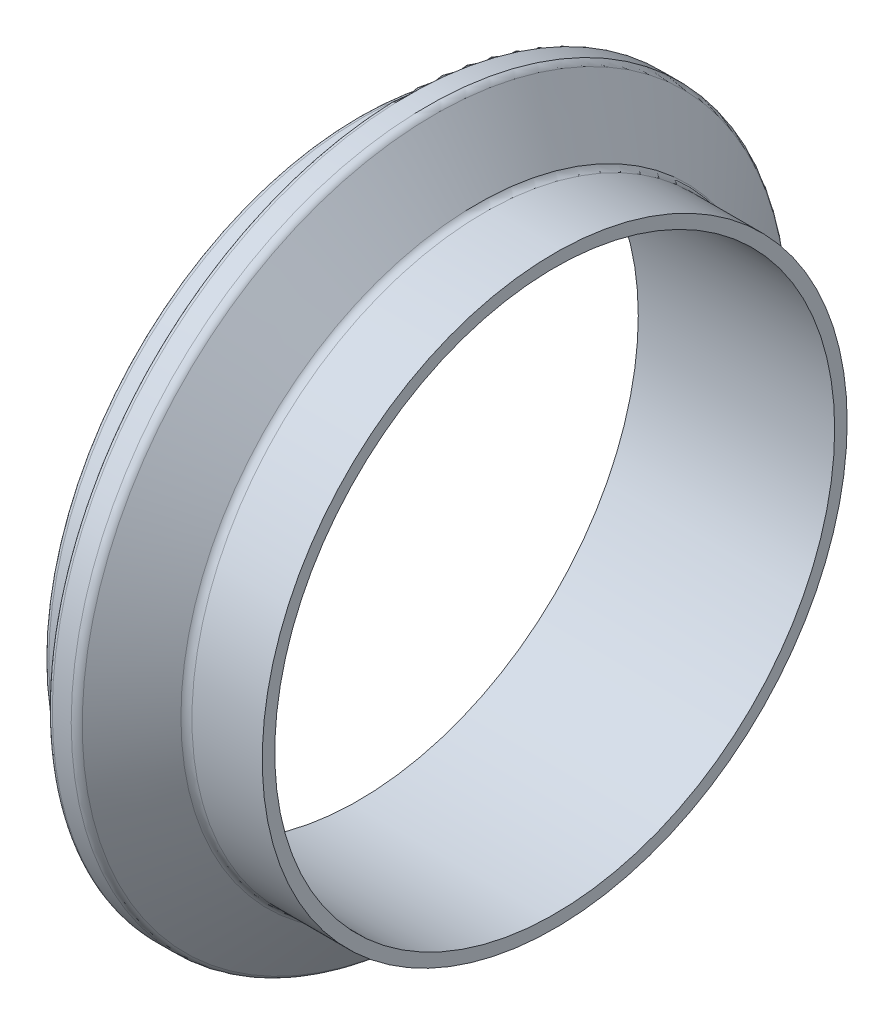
SolidWorks part; units mm, degrees
ref_plane "Front Plane" through (0, 0, 0) normal (0, 0, 1) x (1, 0, 0)
ref_plane "Top Plane" through (0, 0, 0) normal (0, 1, 0) x (1, 0, 0)
ref_plane "Right Plane" through (0, 0, 0) normal (1, 0, 0) x (0, 0, -1)
sketch "Sketch1" plane through (0, 0, 0) normal (0, 0, 1) x (1, 0, 0)
  line L0 (0, 0) -> (-37.0343, 0) construction
  line L1 (0, 48.6283) -> (-34.1122, 48.6283)
  line L2 (-34.1122, 48.6283) -> (-34.1122, 53.7718)
  line L3 (-33.2994, 54.5846) -> (-27.051, 54.5846)
  line L4 (-26.2382, 55.3974) -> (-26.2382, 61.0362)
  line L5 (-25.4254, 61.849) -> (-22.1338, 61.849)
  line L6 (-20.8559, 61.2118) -> (-13.4901, 51.4372)
  line L7 (-12.2122, 50.8) -> (0, 50.8)
  line L8 (0, 50.8) -> (0, 48.6283)
  arc A0 (-25.4254, 61.849) -> (-26.2382, 61.0362) centre (-25.4254, 61.0362) ccw
  arc A1 (-26.2382, 55.3974) -> (-27.051, 54.5846) centre (-27.051, 55.3974) cw
  arc A2 (-33.2994, 54.5846) -> (-34.1122, 53.7718) centre (-33.2994, 53.7718) ccw
  arc A3 (-12.2122, 50.8) -> (-13.4901, 51.4372) centre (-12.2122, 52.4002) cw
  arc A4 (-20.8559, 61.2118) -> (-22.1338, 61.849) centre (-22.1338, 60.2488) ccw
  point P13 (-26.2382, 61.849)
  point P18 (-34.1122, 54.5846)
  point P23 (-21.336, 61.849)
  dimension "D7" = 0.8128
  dimension "D8" = 1.6002
  dimension "D1" = 48.6283
  dimension "D2" = 50.8
  dimension "D3" = 61.849
  dimension "D4" = 54.5846
  dimension "D5" = 4.9022
  dimension "D6" = 7.874
  dimension "D9" = 34.1122
revolve "Revolve1" add sketch "Sketch1" angle 360 about L0
